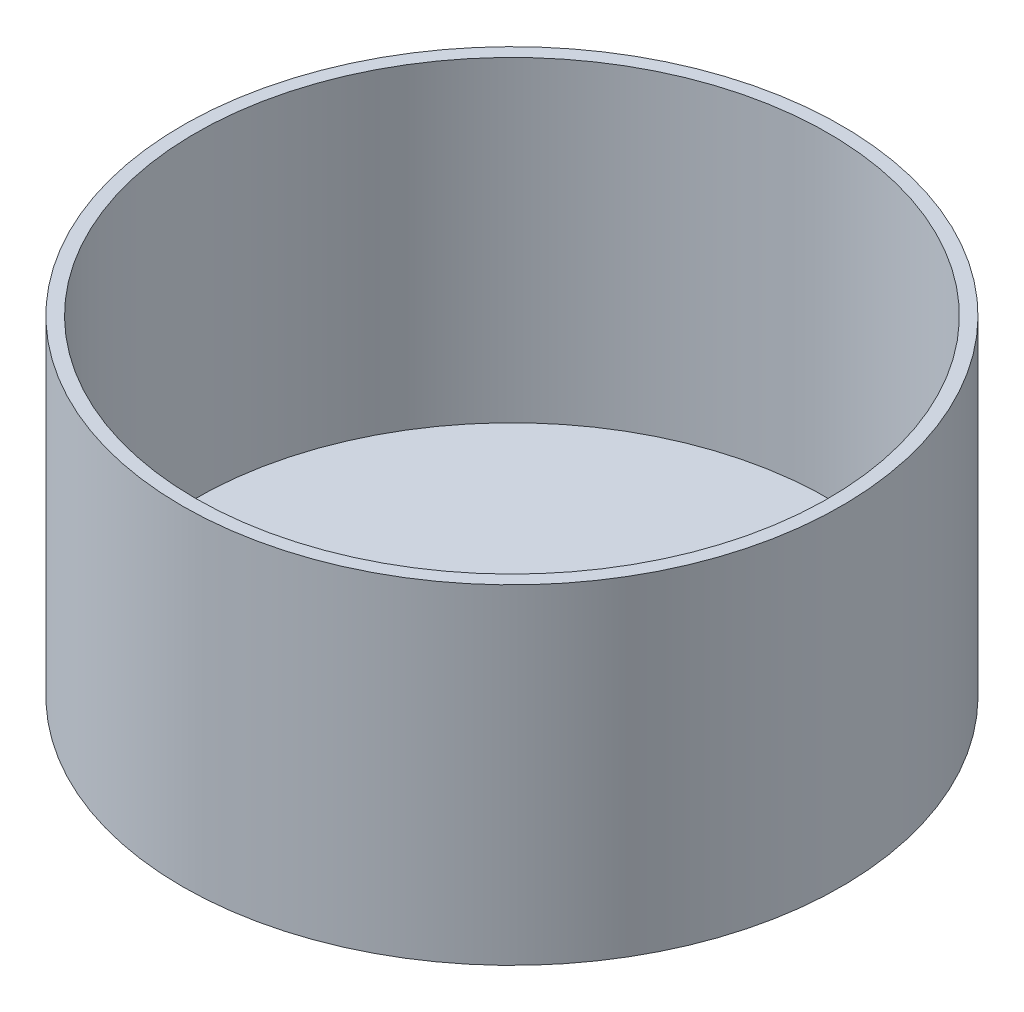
SolidWorks part; units mm, degrees
ref_plane "Front Plane" through (0, 0, 0) normal (0, 0, 1) x (1, 0, 0)
ref_plane "Top Plane" through (0, 0, 0) normal (0, 1, 0) x (1, 0, 0)
ref_plane "Right Plane" through (0, 0, 0) normal (1, 0, 0) x (0, 0, -1)
sketch "Sketch1" plane through (0, 0, 0) normal (0, 1, 0) x (1, 0, 0)
  circle A0 centre (0, 0) radius 63.5
  dimension "D1" = 127
extrude "Boss-Extrude1" add sketch "Sketch1" along normal blind 63.5
shell "Shell1" thickness 2.54
